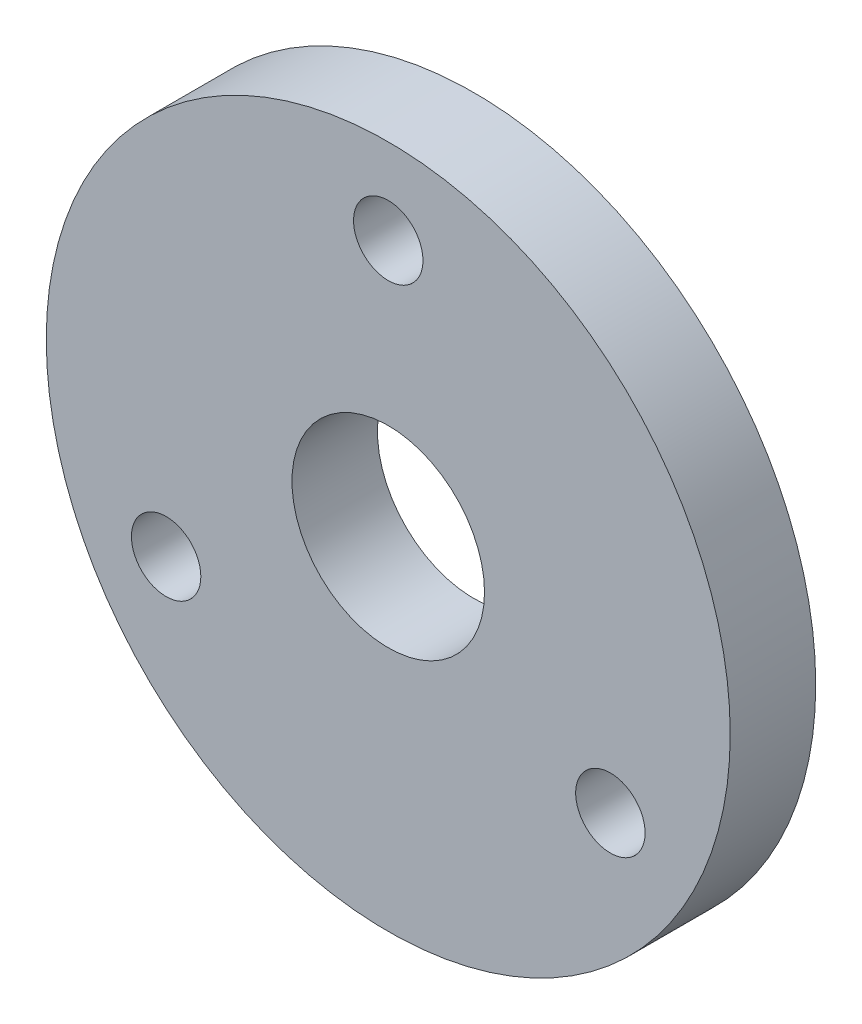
SolidWorks part; units mm, degrees
ref_plane "Front" through (0, 0, 0) normal (0, 0, 1) x (1, 0, 0)
ref_plane "Top" through (0, 0, 0) normal (0, 1, 0) x (1, 0, 0)
ref_plane "Right" through (0, 0, 0) normal (1, 0, 0) x (0, 0, -1)
sketch "Sketch1" plane through (0, 0, 0) normal (0, 0, 1) x (1, 0, 0)
  circle A0 centre (0, 0) radius 25.4
  circle A1 centre (0, 0) radius 7.1501
  dimension "D1" = 50.8
  dimension "D2" = 14.3002
extrude "Extrude1" add sketch "Sketch1" along normal mid plane 6.35
hole_wizard "Hole1" positions "Sketch3" profile "Sketch2" legacy
sketch "Sketch3" plane through (0, 0, 3.175) normal (0, 0, 1) x (1, 0, 0)
  line L0 (0, 0) -> (0, 19.05) construction
  circle A0 centre (0, 0) radius 19.05 construction
  point P0 (0, 19.05)
  dimension "D1" = 38.1
sketch "Sketch2" plane through (0, 19.05, 3.175) normal (1, 0, 0) x (0, -1, 0)
  line L0 (0, 0) -> (0, 100)
  line L1 (0, 100) -> (2.5781, 100)
  line L2 (2.5781, 100) -> (2.5781, 0)
  line L3 (2.5781, 0) -> (0, 0)
  line L4 (0, 110) -> (0, -10) construction
  dimension "Diameter" = 5.1562
  dimension "Depth" = 100
pattern_circular "CirPattern1" count 3 over 360 about axis through (0, 0, 0) along (0, 0, 1) of "Hole1"
